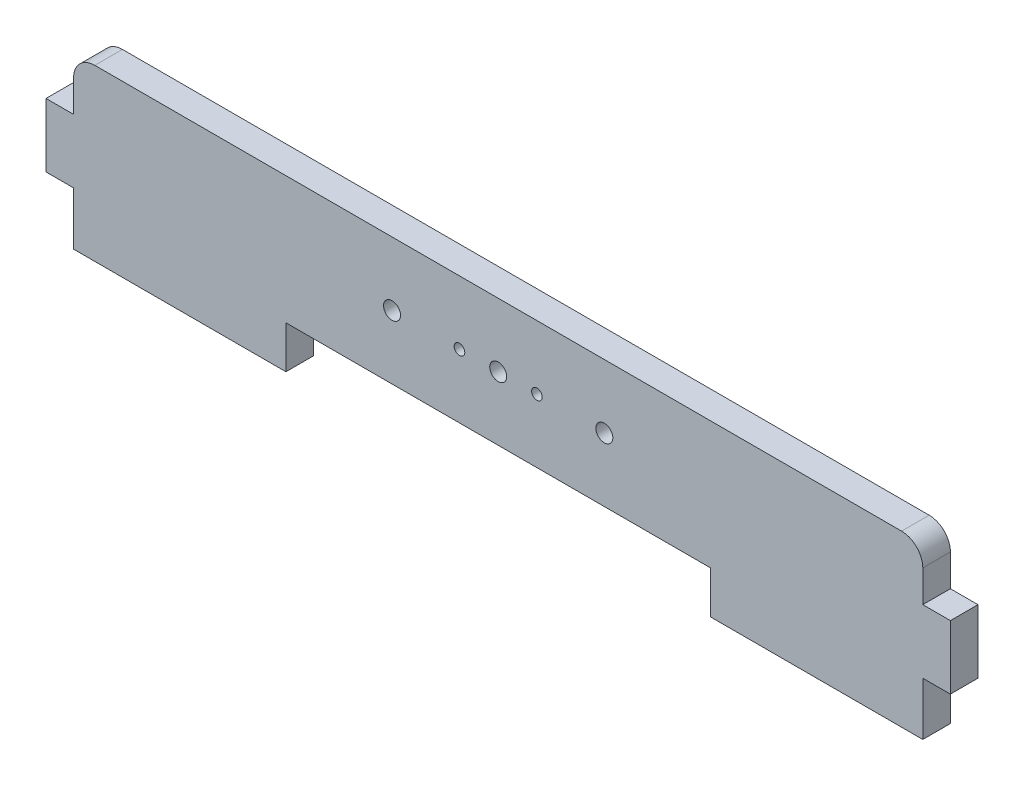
SolidWorks part; units mm, degrees
ref_plane "Alzado" through (0, 0, 0) normal (0, 0, 1) x (1, 0, 0)
ref_plane "Planta" through (0, 0, 0) normal (0, 1, 0) x (1, 0, 0)
ref_plane "Vista lateral" through (0, 0, 0) normal (1, 0, 0) x (0, 0, -1)
sketch "Croquis1" plane through (0, 0, 0) normal (0, 0, 1) x (1, 0, 0)
  line L0 (100, -40) -> (200, -40)
  line L1 (-200, -40) -> (-100, -40)
  line L2 (-200, -40) -> (-200, -15)
  line L3 (-200, 40) -> (200, 40)
  line L4 (200, -40) -> (200, -15)
  line L5 (200, 15) -> (200, 40)
  line L6 (200, 15) -> (213, 15)
  line L7 (-100, -20) -> (100, -20)
  line L8 (-100, -20) -> (-100, -40)
  line L10 (100, -20) -> (100, -40)
  line L12 (200, -15) -> (213, -15)
  line L13 (213, 15) -> (213, -15)
  line L14 (0, 0) -> (0, 63.4179) construction
  line L15 (-200, -15) -> (-213, -15)
  line L16 (-213, 15) -> (-213, -15)
  line L17 (-200, 15) -> (-213, 15)
  line L18 (-200, 15) -> (-200, 40)
  point P0 (0, 0)
  dimension "D1" = 400
  dimension "D2" = 80
  dimension "D3" = 100
  dimension "D4" = 100
  dimension "D5" = 60
  dimension "D6" = 13
  dimension "D7" = 25
  dimension "D8" = 25
extrude "Saliente-Extruir1" add sketch "Croquis1" along normal blind 13
sketch "Croquis2" plane through (0, 0, 0) normal (0, 0, -1) x (-1, 0, 0)
  line L0 (0, -20) -> (0, 10) construction
  line L1 (0, 14) -> (0, -20) construction
  line L2 (-200, 40) -> (200, 40) construction
  line L3 (0, 10) -> (54, 10) construction
  line L4 (-50, 10) -> (0, 10) construction
  line L16 (-46, 10) -> (-54, 10) construction
  line L20 (46, 10) -> (54, 10) construction
  line L23 (0, 14) -> (0, 40) construction
  circle A0 centre (0, 10) radius 4
  circle A1 centre (50, 10) radius 4
  circle A2 centre (-50, 10) radius 4
  circle A7 centre (18.25, 10) radius 2.5
  circle A8 centre (-18.25, 10) radius 2.5
  dimension "D1" = 8
  dimension "D2" = 8
  dimension "D3" = 8
  dimension "D6" = 36.5
  dimension "D7" = 18.25
  dimension "D4" = 5
  dimension "D5" = 5
  dimension "D10" = 50
  dimension "D11" = 50
extrude "Cortar-Extruir1" cut sketch "Croquis2" against normal blind 13
fillet "Redondeo1" radius 10 1 edges at (-200, 40, 6.5)
fillet "Redondeo2" radius 10 1 edges at (200, 40, 6.5)
